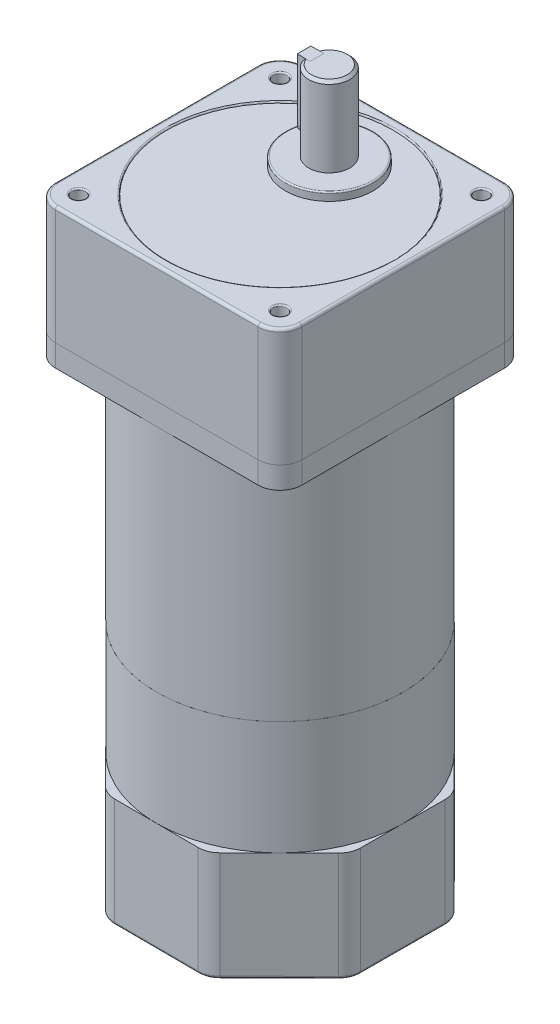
SolidWorks part; units mm, degrees
ref_plane "前视基准面" through (0, 0, 0) normal (0, 0, 1) x (1, 0, 0)
ref_plane "上视基准面" through (0, 0, 0) normal (0, 1, 0) x (1, 0, 0)
ref_plane "右视基准面" through (0, 0, 0) normal (1, 0, 0) x (0, 0, -1)
sketch "草图1" plane through (0, 0, 0) normal (0, 1, 0) x (1, 0, 0)
  line L1 (-37, -45) -> (37, -45)
  line L2 (-45, -37) -> (-45, 37)
  line L3 (-37, 45) -> (37, 45)
  line L4 (45, -37) -> (45, 37)
  line L5 (-45, -45) -> (45, 45) construction
  line L6 (-45, 45) -> (45, -45) construction
  arc A0 (-45, 37) -> (-37, 45) centre (-37, 37) cw
  arc A1 (-37, -45) -> (-45, -37) centre (-37, -37) cw
  arc A2 (37, 45) -> (45, 37) centre (37, 37) cw
  arc A3 (37, -45) -> (45, -37) centre (37, -37) ccw
  point P0 (0, 0)
  dimension "D1" = 8
extrude "凸台-拉伸1" add sketch "草图1" against normal blind 43
sketch "草图2" plane through (0, -43, 0) normal (0, -1, 0) x (1, 0, 0)
  line L0 (-37, 45) -> (37, 45) construction
  line L1 (-37, -45) -> (37, -45)
  line L2 (-45, -37) -> (-45, 37)
  line L3 (-37, 45) -> (37, 45)
  line L4 (45, -37) -> (45, 37)
  line L5 (-45, -45) -> (45, 45) construction
  line L6 (-45, 45) -> (45, -45) construction
  arc A0 (-37, -45) -> (-45, -37) centre (-37, -37) cw
  arc A1 (37, -45) -> (45, -37) centre (37, -37) ccw
  arc A2 (37, 45) -> (45, 37) centre (37, 37) cw
  arc A3 (-45, 37) -> (-37, 45) centre (-37, 37) cw
  point P0 (0, 0)
  dimension "D1" = 8
extrude "凸台-拉伸2" add sketch "草图2" along normal blind 8 separate body
sketch "草图3" plane through (0, -51, 0) normal (0, -1, 0) x (1, 0, 0)
  circle A0 centre (0, 0) radius 45
extrude "凸台-拉伸3" add sketch "草图3" along normal blind 84 separate body
sketch "草图4" plane through (0, -135, 0) normal (0, -1, 0) x (1, 0, 0)
  circle A0 centre (0, 0) radius 45
extrude "凸台-拉伸4" add sketch "草图4" along normal blind 41.5 separate body
sketch "草图5" plane through (0, -176.5, 0) normal (0, -1, 0) x (1, 0, 0)
  line L1 (15.1674, 45.0537) -> (-15.4843, 44.9458)
  line L2 (-21.1328, 42.5827) -> (-42.7305, 20.8324)
  line L3 (-45.0537, 15.1674) -> (-44.9458, -15.4843)
  line L4 (-42.5827, -21.1328) -> (-20.8324, -42.7305)
  line L5 (-15.1674, -45.0537) -> (15.4843, -44.9458)
  line L6 (21.1328, -42.5827) -> (42.7305, -20.8324)
  line L7 (45.0537, -15.1674) -> (44.9458, 15.4843)
  line L8 (42.5827, 21.1328) -> (20.8324, 42.7305)
  circle A0 centre (0, 0) radius 45 construction
  arc A1 (44.9458, 15.4843) -> (42.5827, 21.1328) centre (36.9458, 15.4561) ccw
  arc A2 (42.7305, -20.8324) -> (45.0537, -15.1674) centre (37.0537, -15.1955) ccw
  arc A3 (15.4843, -44.9458) -> (21.1328, -42.5827) centre (15.4561, -36.9458) ccw
  arc A4 (-20.8324, -42.7305) -> (-15.1674, -45.0537) centre (-15.1955, -37.0537) ccw
  arc A5 (-44.9458, -15.4843) -> (-42.5827, -21.1328) centre (-36.9458, -15.4561) ccw
  arc A6 (-42.7305, 20.8324) -> (-45.0537, 15.1674) centre (-37.0537, 15.1955) ccw
  arc A7 (15.1674, 45.0537) -> (20.8324, 42.7305) centre (15.1955, 37.0537) cw
  arc A8 (-15.4843, 44.9458) -> (-21.1328, 42.5827) centre (-15.4561, 36.9458) ccw
  dimension "D1" = 8
extrude "凸台-拉伸5" add sketch "草图5" along normal blind 40 separate body
fillet "圆角1" radius 1 16 edges at (44.9997, -216.5, 0.1584) (44.4555, -216.5, -18.231) (31.9316, -216.5, -31.7076) (18.5436, -216.5, -44.326) (0.1584, -216.5, -44.9997) (-18.231, -216.5, -44.4555) (-31.7076, -216.5, -31.9316) (-44.326, -216.5, -18.5436) (-44.9997, -216.5, -0.1584) (-44.4555, -216.5, 18.231) (-31.9316, -216.5, 31.7076) (-18.5436, -216.5, 44.326) (-0.1584, -216.5, 44.9997) (18.231, -216.5, 44.4555) (31.7076, -216.5, 31.9316) (44.326, -216.5, 18.5436)
fillet "圆角2" radius 1 8 edges at (0, 0, -45) (42.6569, 0, -42.6569) (45, 0, 0) (42.6569, 0, 42.6569) (0, 0, 45) (-42.6569, 0, 42.6569) (-45, 0, 0) (-42.6569, 0, -42.6569)
sketch "草图6" plane through (0, 0, 0) normal (0, 1, 0) x (1, 0, 0)
  point P19 (36.7696, -36.7696)
  point P20 (-36.7696, -36.7696)
  point P21 (-36.7696, 36.7696)
  point P22 (36.7696, 36.7696)
hole_wizard "M6 螺纹孔1" positions "3D草图1" profile "草图7" tap size "M6" standard "GB"
sketch3d "3D草图1"
  point P0 (36.7696, 0, 36.7696)
  point P3 (-36.7696, 0, 36.7696)
  point P6 (-36.7696, 0, -36.7696)
  point P9 (36.7696, 0, -36.7696)
sketch "草图7" plane through (36.7696, 0, 36.7696) normal (1, 0, 0) x (0, 0, 1)
  line L0 (0, 0) -> (0, 18.5022)
  line L1 (0, 18.5022) -> (2.5, 17)
  line L2 (2.5, 17) -> (2.5, 0)
  line L5 (2.5, 0) -> (0, 0)
  line L10 (0, 18.5022) -> (-2.5, 17) construction
  line L11 (0, -6.35) -> (0, 107.95) construction
  dimension "螺纹孔钻头直径" = 5
  dimension "螺纹孔钻头深度" = 17
  dimension "导头角度" = 118
sketch "草图8" plane through (0, -51, 0) normal (0, -1, 0) x (1, 0, 0)
  circle A1 centre (-36.7696, 36.7696) radius 3.5
  circle A2 centre (36.7696, 36.7696) radius 3.5
  circle A3 centre (36.7696, -36.7696) radius 3.5
  circle A4 centre (-36.7696, -36.7696) radius 3.5
extrude "切除-拉伸1" cut sketch "草图8" against normal blind 34
fillet "圆角3" radius 0.5 4 edges at (36.7696, 0, -34.2696) (-36.7696, 0, -34.2696) (-36.7696, 0, 39.2696) (36.7696, 0, 39.2696)
sketch "草图9" plane through (0, 0, 0) normal (0, 1, 0) x (1, 0, 0)
  circle A0 centre (0, 18) radius 16
extrude "凸台-拉伸6" add sketch "草图9" along normal blind 3 separate body
fillet "圆角4" radius 0.5 1 edges at (0, 3, -2)
sketch "草图10" plane through (0, 3, 0) normal (0, 1, 0) x (1, 0, 0)
  circle A0 centre (0, 18) radius 7.5
extrude "凸台-拉伸7" add sketch "草图10" along normal blind 29 separate body
sketch "草图11" plane through (0, 0, 0) normal (0, 1, 0) x (1, 0, 0)
  circle A0 centre (0, 0) radius 41.4
extrude "切除-拉伸2" cut sketch "草图11" against normal blind 0.5
fillet "圆角5" radius 0.5 1 edges at (0, 0, 41.4)
ref_plane "基准面2" through (-7.5, 0, 0) normal (1, 0, 0) x (0, 0, -1)
sketch "草图13" plane through (-7.5, 0, 0) normal (1, 0, 0) x (0, 0, -1)
  line L1 (25.5, 32) -> (10.5, 32) construction
  line L2 (20.5, 9.5) -> (20.5, 32)
  line L3 (20.5, 32) -> (15.5, 32)
  line L4 (15.5, 32) -> (15.5, 9.5)
  arc A0 (15.5, 9.5) -> (20.5, 9.5) centre (18, 9.5) ccw
extrude "切除-拉伸6" cut sketch "草图13" along normal blind 3
sketch "草图14" plane through (-4.5, 0, 0) normal (-1, 0, 0) x (0, 0, 1)
  line L0 (-20.5, 9.5) -> (-20.5, 32)
  line L1 (-20.5, 32) -> (-15.5, 32)
  line L2 (-15.5, 32) -> (-15.5, 9.5)
  arc A0 (-20.5, 9.5) -> (-15.5, 9.5) centre (-18, 9.5) ccw
extrude "凸台-拉伸8" add sketch "草图14" along normal blind 5 separate body
chamfer "倒角2" distance 0.3 angle 45 4 edges at (-9.5, 32, -18) (-9.5, 20.75, -20.5) (-9.5, 7, -18) (-9.5, 20.75, -15.5)
chamfer "倒角3" distance 1 angle 45 1 edges at (7.5, 32, -18)
